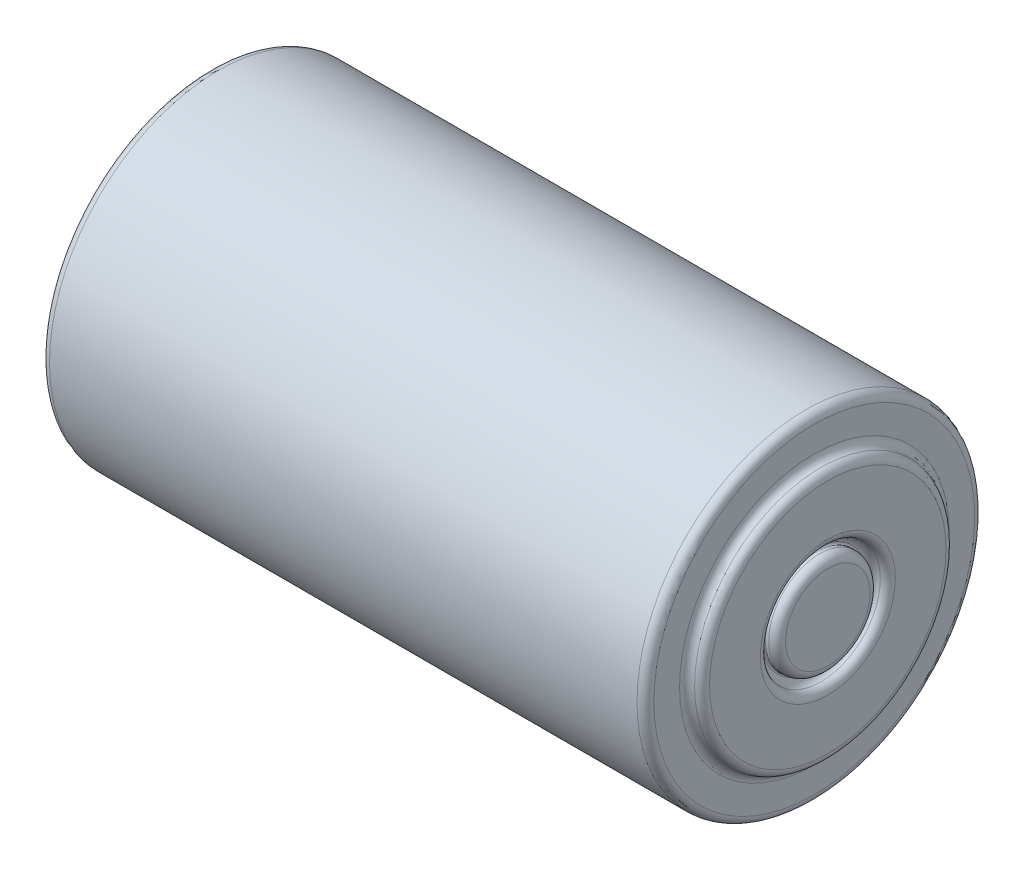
SolidWorks part; units mm, degrees
ref_plane "Plane1" through (0, 0, 0) normal (0, 0, 1) x (1, 0, 0)
ref_plane "Plane2" through (0, 0, 0) normal (0, 1, 0) x (1, 0, 0)
ref_plane "Plane3" through (0, 0, 0) normal (1, 0, 0) x (0, 0, -1)
sketch "Sketch1" plane through (0, 0, 0) normal (0, 0, 1) x (1, 0, 0)
  line L0 (0, 12.7) -> (45.466, 12.7)
  line L1 (0, 12.7) -> (0, 0)
  line L2 (45.466, 0) -> (0, 0)
  line L3 (45.466, 0) -> (45.466, 12.7)
  line L4 (-20, 0) -> (180, 0) construction
  dimension "D1" = 12.7
  dimension "D2" = 45.466
revolve "Base-Revolve" add sketch "Sketch1" angle 360 about L4
sketch "Sketch2" plane through (0, 0, 0) normal (-1, 0, 0) x (0, 0, 1)
  circle A0 centre (0, 0) radius 8.128
  circle A1 centre (0, 0) radius 6.604
  dimension "D1" = 16.256
  dimension "D2" = 13.208
extrude "Boss-Extrude1" add sketch "Sketch2" along normal blind 0.508
sketch "Sketch3" plane through (0, 0, 0) normal (-1, 0, 0) x (0, 0, 1)
  circle A0 centre (0, 0) radius 3.302
  dimension "D1" = 6.604
extrude "Boss-Extrude2" add sketch "Sketch3" along normal blind 2.54
sketch "Sketch4" plane through (45.466, 0, 0) normal (1, 0, 0) x (0, 0, -1)
  circle A0 centre (0, 0) radius 9.525
  circle A1 centre (0, 0) radius 4.445
  dimension "D1" = 19.05
  dimension "D2" = 8.89
extrude "Boss-Extrude3" add sketch "Sketch4" along normal blind 1.016
sketch "Sketch5" plane through (45.466, 0, 0) normal (1, 0, 0) x (0, 0, -1)
  circle A0 centre (0, 0) radius 3.81
  dimension "D1" = 7.62
extrude "Boss-Extrude4" add sketch "Sketch5" along normal blind 1.016
fillet "Fillet14" radius 0.635
fillet "Fillet19" radius 0.635
fillet "Fillet20" radius 0.635
fillet "Fillet24" radius 0.127
